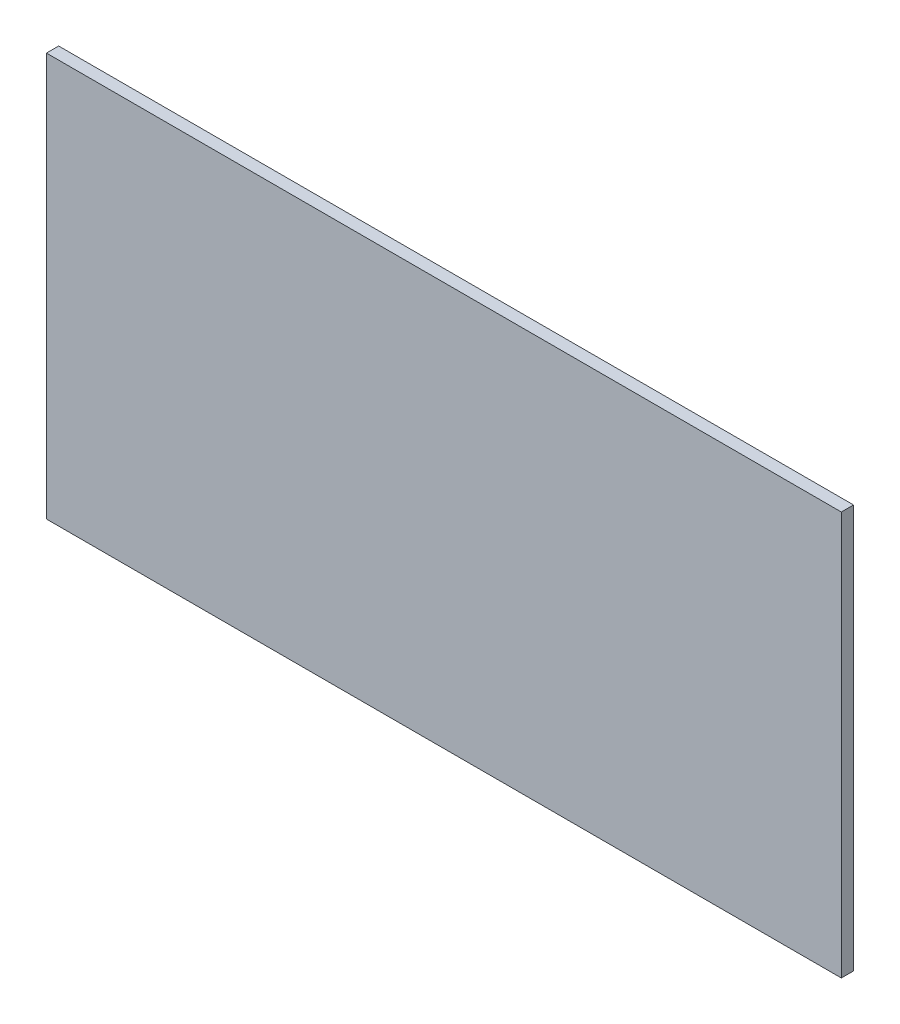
SolidWorks part; units mm, degrees
ref_plane "Front Plane" through (0, 0, 0) normal (0, 0, 1) x (1, 0, 0)
ref_plane "Top Plane" through (0, 0, 0) normal (0, 1, 0) x (1, 0, 0)
ref_plane "Right Plane" through (0, 0, 0) normal (1, 0, 0) x (0, 0, -1)
sketch "Sketch1" plane through (0, 0, 0) normal (0, 0, 1) x (1, 0, 0)
  line L1 (-412.75, -209.55) -> (412.75, -209.55)
  line L2 (-412.75, -209.55) -> (-412.75, 209.55)
  line L3 (-412.75, 209.55) -> (412.75, 209.55)
  line L4 (412.75, -209.55) -> (412.75, 209.55)
  line L5 (-412.75, -209.55) -> (412.75, 209.55) construction
  line L6 (-412.75, 209.55) -> (412.75, -209.55) construction
  point P0 (0, 0)
  dimension "D1" = 419.1
  dimension "D2" = 825.5
extrude "Extrude1" add sketch "Sketch1" along normal mid plane 12.7
